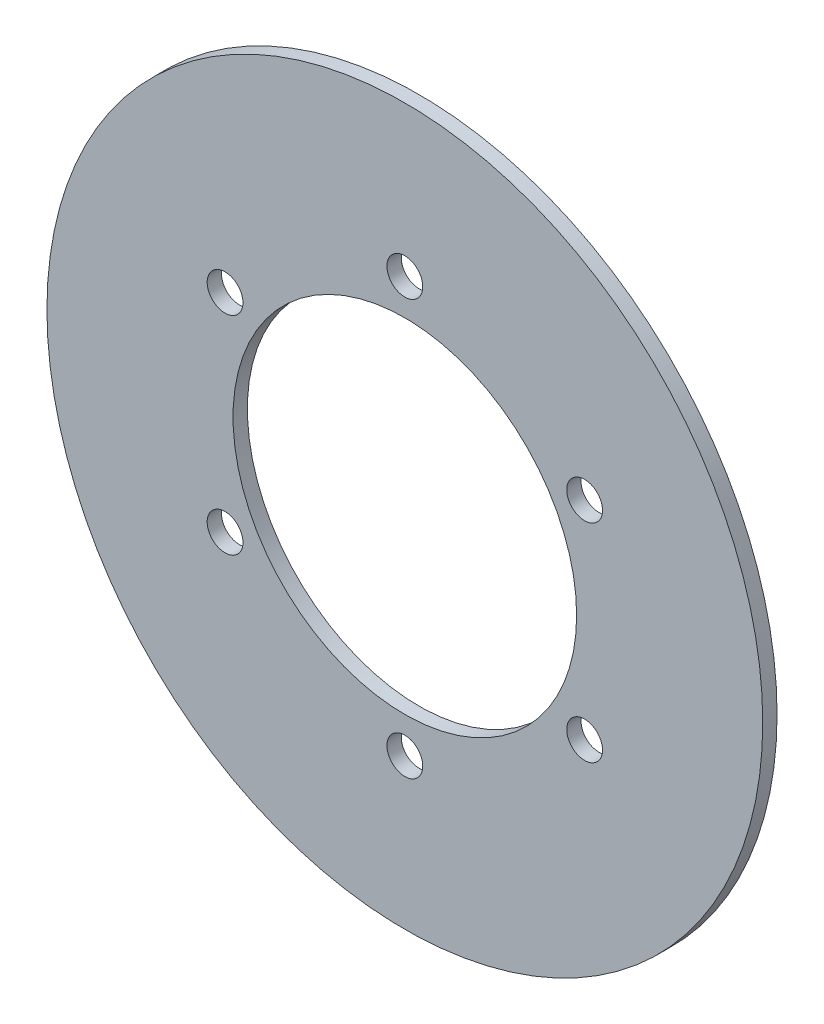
SolidWorks part; units mm, degrees
ref_plane "Front Plane" through (0, 0, 0) normal (0, 0, 1) x (1, 0, 0)
ref_plane "Top Plane" through (0, 0, 0) normal (0, 1, 0) x (1, 0, 0)
ref_plane "Right Plane" through (0, 0, 0) normal (1, 0, 0) x (0, 0, -1)
sketch "Sketch1" plane through (0, 0, 0) normal (0, 0, 1) x (1, 0, 0)
  line L0 (0, 0) -> (0, 29) construction
  circle A0 centre (0, 0) radius 50
  circle A1 centre (0, 0) radius 24
  circle A2 centre (0, 0) radius 29 construction
  circle A3 centre (0, 29) radius 2.5
  circle A4 centre (25.1147, 14.5) radius 2.5
  circle A5 centre (25.1147, -14.5) radius 2.5
  circle A6 centre (0, -29) radius 2.5
  circle A7 centre (-25.1147, -14.5) radius 2.5
  circle A8 centre (-25.1147, 14.5) radius 2.5
  point P19 (0, 0)
  dimension "D1" = 100
  dimension "D2" = 48
  dimension "D3" = 58
  dimension "D4" = 5
  dimension "D5" = 6
extrude "Boss-Extrude1" add sketch "Sketch1" along normal blind 2
